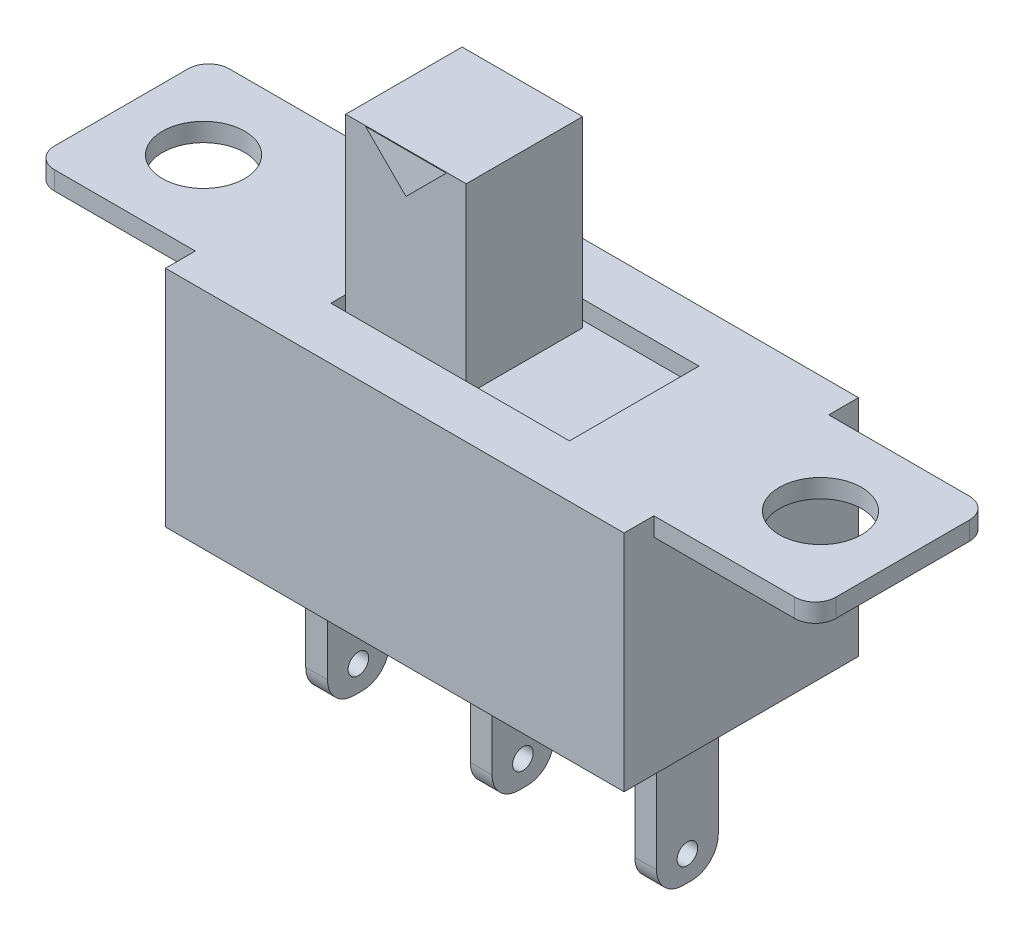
SolidWorks part; units mm, degrees
ref_plane "Plan de face" through (0, 0, 0) normal (0, 0, 1) x (1, 0, 0)
ref_plane "Plan de dessus" through (0, 0, 0) normal (0, 1, 0) x (1, 0, 0)
ref_plane "Plan de droite" through (0, 0, 0) normal (1, 0, 0) x (0, 0, -1)
sketch "Esquisse1" plane through (0, 0, 0) normal (0, 1, 0) x (1, 0, 0)
  line L0 (14.2184, 6.2273) -> (14.2184, 5.5023)
  line L1 (3.0684, 0.5273) -> (14.2184, 0.5273)
  line L2 (-0.8566, 1.2523) -> (-0.8566, 5.5023)
  line L3 (3.0684, 6.2273) -> (14.2184, 6.2273)
  line L4 (18.1434, 1.2523) -> (18.1434, 5.5023)
  line L5 (14.2184, 5.5023) -> (18.1434, 5.5023)
  line L6 (8.6434, 6.2273) -> (8.6434, 0.5273) construction
  line L7 (-0.8566, 3.3773) -> (18.1434, 3.3773) construction
  line L8 (3.0684, 5.5023) -> (-0.8566, 5.5023)
  line L9 (3.0684, 6.2273) -> (3.0684, 5.5023)
  line L10 (14.2184, 1.2523) -> (18.1434, 1.2523)
  line L11 (14.2184, 0.5273) -> (14.2184, 1.2523)
  line L12 (3.0684, 0.5273) -> (3.0684, 1.2523)
  line L13 (3.0684, 1.2523) -> (-0.8566, 1.2523)
  line L15 (5.8152, 4.9523) -> (11.6152, 4.9523)
  line L16 (5.8152, 4.9523) -> (5.8152, 1.8023)
  line L17 (5.8152, 1.8023) -> (11.6152, 1.8023)
  line L18 (11.6152, 4.9523) -> (11.6152, 1.8023)
  circle A0 centre (16.1434, 3.3773) radius 1
  circle A1 centre (1.1434, 3.3773) radius 1
  dimension "D2" = 2
  dimension "D4" = 2
  dimension "D9" = 7.5
  dimension "D8" = 3.925
  dimension "D1" = 0.725
  dimension "D3" = 11.15
  dimension "D5" = 1.575
  dimension "D6" = 3.15
  dimension "D7" = 5.8
  dimension "D10" = 19
extrude "Extrusion1" add sketch "Esquisse1" along normal blind 0.45
sketch "Esquisse2" plane through (0, 0, 0) normal (0, -1, 0) x (1, 0, 0)
  line L1 (14.2184, -0.5273) -> (3.0684, -0.5273)
  line L2 (14.2184, -0.5273) -> (14.2184, -6.2273)
  line L3 (14.2184, -6.2273) -> (3.0684, -6.2273)
  line L4 (3.0684, -0.5273) -> (3.0684, -6.2273)
extrude "Extrusion2" add sketch "Esquisse2" along normal blind 5
sketch "Esquisse3" plane through (0, -5, 0) normal (0, -1, 0) x (1, 0, 0)
  line L0 (14.2184, -3.3773) -> (3.0684, -3.3773) construction
  line L1 (14.2184, -6.2273) -> (14.2184, -0.5273) construction
  line L2 (3.0684, -0.5273) -> (3.0684, -6.2273) construction
  line L3 (8.6434, -6.2273) -> (8.6434, -0.5273) construction
  line L4 (3.0684, -6.2273) -> (14.2184, -6.2273) construction
  line L5 (14.2184, -0.5273) -> (3.0684, -0.5273) construction
  line L6 (12.9084, -2.6273) -> (12.3784, -2.6273)
  line L7 (8.9084, -2.6273) -> (8.3784, -2.6273)
  line L8 (8.9084, -2.6273) -> (8.9084, -4.1273)
  line L9 (8.9084, -4.1273) -> (8.3784, -4.1273)
  line L10 (8.3784, -2.6273) -> (8.3784, -4.1273)
  line L11 (12.9084, -2.6273) -> (12.9084, -4.1273)
  line L12 (12.9084, -4.1273) -> (12.3784, -4.1273)
  line L13 (12.3784, -2.6273) -> (12.3784, -4.1273)
  line L14 (4.9084, -2.6273) -> (4.3784, -2.6273)
  line L15 (4.9084, -2.6273) -> (4.9084, -4.1273)
  line L16 (4.9084, -4.1273) -> (4.3784, -4.1273)
  line L17 (4.3784, -2.6273) -> (4.3784, -4.1273)
  dimension "D1" = 1.5
  dimension "D2" = 0.75
  dimension "D3" = 0.53
  dimension "D4" = 0.265
extrude "Extrusion3" add sketch "Esquisse3" along normal blind 4
fillet "Congé1" radius 0.65 6 edges at (4.6434, -9, -2.6273) (4.6434, -9, -4.1273) (8.6434, -9, -2.6273) (8.6434, -9, -4.1273) (12.6434, -9, -2.6273) (12.6434, -9, -4.1273)
sketch "Esquisse4" plane through (4.3784, 0, 0) normal (-1, 0, 0) x (0, 0, 1)
  line L0 (-3.3773, -9) -> (-3.3773, -5) construction
  line L1 (-3.2773, -9) -> (-3.4773, -9) construction
  line L2 (-0.5273, -5) -> (-6.2273, -5) construction
  circle A0 centre (-3.3773, -8.3826) radius 0.25
extrude "Enlèv. mat.-Extru.1" cut sketch "Esquisse4" against normal through all
sketch "Esquisse5" plane through (0, 0, 0) normal (0, 1, 0) x (-1, 0, 0)
  line L0 (-11.6152, -3.3773) -> (-5.8152, -3.3773) construction
  line L1 (-8.9452, -4.7923) -> (-6.0152, -4.7923)
  line L2 (-8.9452, -4.7923) -> (-8.9452, -1.9623)
  line L3 (-8.9452, -1.9623) -> (-6.0152, -1.9623)
  line L4 (-6.0152, -4.7923) -> (-6.0152, -1.9623)
  line L5 (-11.6152, -1.8023) -> (-11.6152, -4.9523) construction
  line L6 (-5.8152, -4.9523) -> (-5.8152, -1.8023) construction
  line L7 (-8.9452, -3.3773) -> (-6.0152, -3.3773) construction
  dimension "D1" = 2.83
  dimension "D2" = 2.93
  dimension "D3" = 0.2
extrude "Extrusion4" add sketch "Esquisse5" along normal blind 4.45
sketch "Esquisse6" plane through (0, 0, -1.9623) normal (0, 0, 1) x (1, 0, 0)
  line L0 (7.4802, 4.45) -> (7.4802, 2.4309) construction
  line L1 (6.0152, 4.45) -> (8.9452, 4.45) construction
  line L2 (7.4802, 3.45) -> (8.4631, 4.433)
  line L3 (8.4631, 4.433) -> (6.4972, 4.433)
  line L4 (6.4972, 4.433) -> (7.4802, 3.45)
  dimension "D1" = 45
  dimension "D2" = 1
extrude "Enlèv. mat.-Extru.2" cut sketch "Esquisse6" against normal through all
fillet "Congé2" radius 0.5 6 edges at (18.1434, 0.225, -5.5023) (18.1434, 0.225, -1.2523) (-0.8566, 0.225, -1.2523) (-0.8566, 0.225, -5.5023)
